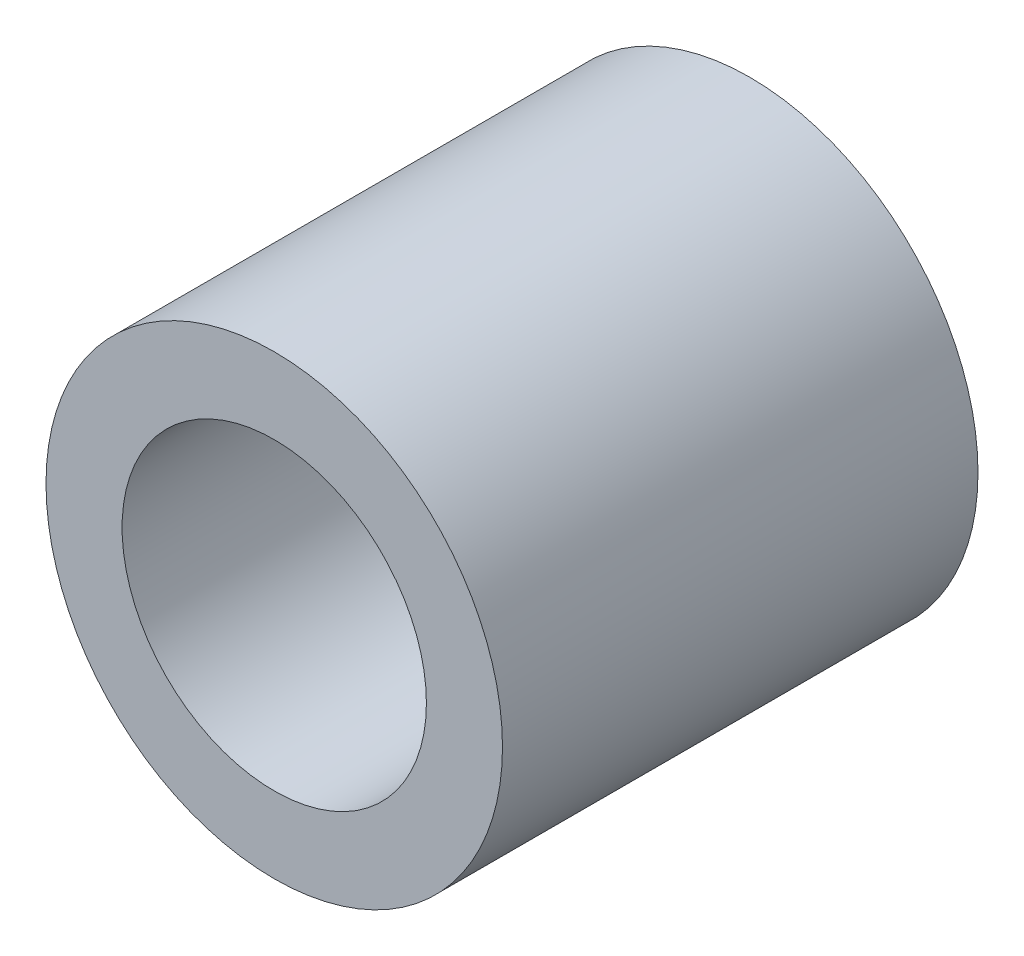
SolidWorks part; units mm, degrees
ref_plane "Face" through (0, 0, 0) normal (0, 0, 1) x (1, 0, 0)
ref_plane "Dessus" through (0, 0, 0) normal (0, 1, 0) x (1, 0, 0)
ref_plane "Droite" through (0, 0, 0) normal (1, 0, 0) x (0, 0, -1)
sketch "Esquisse1" plane through (0, 0, 0) normal (0, 0, 1) x (1, 0, 0)
  circle A0 centre (0, 98) radius 12
  circle A1 centre (0, 98) radius 8
  circle A2 centre (0, 98) radius 12 construction
  dimension "D1" = 16
extrude "Base-Extrusion" add sketch "Esquisse1" against normal up to surface (25 mm away)
